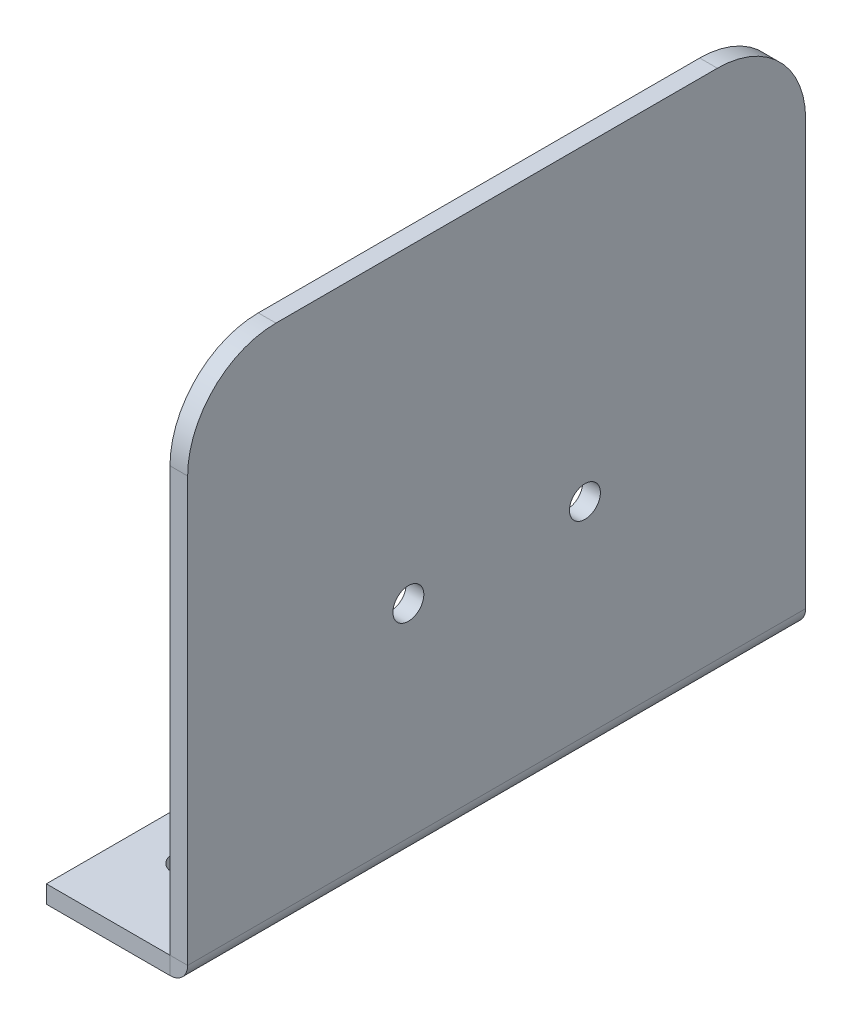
SolidWorks part; units mm, degrees
ref_plane "Front" through (0, 0, 0) normal (0, 0, 1) x (1, 0, 0)
ref_plane "Top" through (0, 0, 0) normal (0, 1, 0) x (1, 0, 0)
ref_plane "Right" through (0, 0, 0) normal (1, 0, 0) x (0, 0, -1)
sketch "Sketch1" plane through (0, 0, 0) normal (0, 1, 0) x (1, 0, 0)
  line L1 (0, 0) -> (66, 0)
  line L2 (0, 0) -> (0, 70)
  line L3 (0, 70) -> (66, 70)
  line L4 (76, 10) -> (76, 60)
  circle A0 centre (41, 45) radius 1.75
  circle A1 centre (41, 25) radius 1.75
  arc A4 (76, 60) -> (66, 70) centre (66, 60) ccw
  arc A5 (76, 10) -> (66, 0) centre (66, 10) cw
  circle A6 centre (6, 60) radius 1.75
  circle A7 centre (6, 10) radius 1.75
  dimension "D1" = 35
  dimension "D2" = 35
sheet metal parameters "Sheet-Metal1" thickness 2 parameters "D1"=0
base flange "Base-Flange1" sketch "Sketch1" thickness 2 reverse thickness direction yes parameters "D1"=0
sketch "Sketch3" plane through (0, 2, 0) normal (0, 1, 0) x (-1, 0, 0)
  line L1 (-16, 0) -> (-16, -70)
sketched bend "Sketched Bend1" parameters "D1"=0
bend "SketchBend1" bend radius 0 bend angle 90 parameters "D5"=1
flat pattern "Flat-Pattern1"
sketch "Bend-Lines1" plane through (0, 2, 0) normal (0, 1, 0) x (-1, 0, 0)
  line L0 (-16, -70) -> (-16, 0) construction
bend of the flat pattern "Flatten-<SketchBend1>1"
